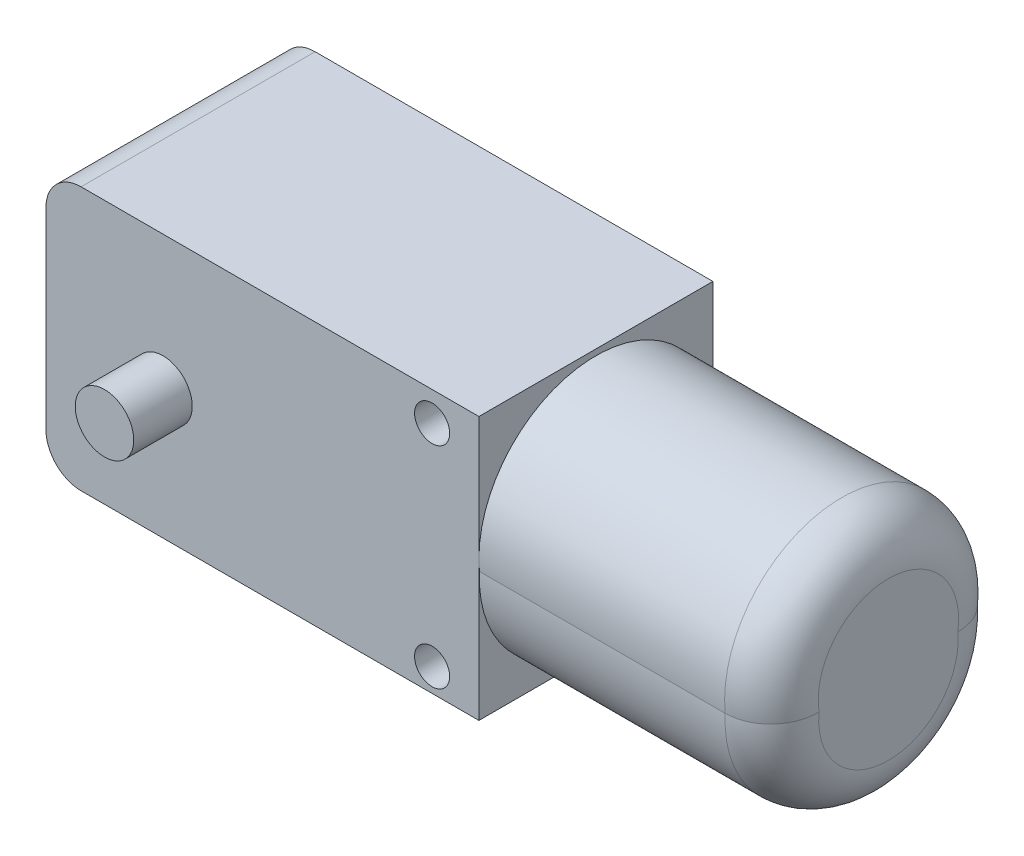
SolidWorks part; units mm, degrees
ref_plane "Front Plane" through (0, 0, 0) normal (0, 0, 1) x (1, 0, 0)
ref_plane "Top Plane" through (0, 0, 0) normal (0, 1, 0) x (1, 0, 0)
ref_plane "Right Plane" through (0, 0, 0) normal (1, 0, 0) x (0, 0, -1)
sketch "Sketch1" plane through (0, 0, 0) normal (0, 0, 1) x (1, 0, 0)
  line L1 (-64.2641, -2.5) -> (-27.2641, -2.5)
  line L2 (-64.2641, -2.5) -> (-64.2641, -25)
  line L3 (-64.2641, -25) -> (-27.2641, -25)
  line L4 (-27.2641, -2.5) -> (-27.2641, -25)
  dimension "D1" = 22.5
  dimension "D2" = 37
extrude "Boss-Extrude1" add sketch "Sketch1" against normal blind 20
sketch "Sketch2" plane through (-27.2641, 0, 0) normal (1, 0, 0) x (0, 0, -1)
  line L0 (20, -25) -> (0, -25) construction
  line L1 (20, -2.5) -> (0, -2.5) construction
  arc A0 (0.0501, -14) -> (19.9499, -14) centre (10, -14.5) ccw
  arc A1 (19.9499, -14) -> (0.0501, -14) centre (10, -13) ccw
  dimension "D2" = 12
  dimension "D1" = 12
extrude "Boss-Extrude2" add sketch "Sketch2" along normal blind 25
sketch "Sketch3" plane through (0, 0, 0) normal (0, 0, 1) x (1, 0, 0)
  circle A0 centre (-54.2641, -14) radius 2.5
  dimension "D1" = 5
extrude "Boss-Extrude3" add sketch "Sketch3" along normal blind 5
sketch "Sketch4" plane through (0, 0, -20) normal (0, 0, -1) x (-1, 0, 0)
  circle A1 centre (54.2641, -14) radius 2.5
  circle A2 centre (54.2641, -14) radius 2.5
  dimension "D1" = 0
extrude "Boss-Extrude4" add sketch "Sketch4" along normal blind 5
fillet "Fillet1" radius 3 2 edges at (-64.2641, -2.5, -10) (-64.2641, -25, -10)
fillet "Fillet2" radius 4 2 edges at (-2.2641, -3, -10) (-2.2641, -24.4624, -10)
sketch "Sketch5" plane through (-64.2641, 0, 0) normal (-1, 0, 0) x (0, 0, 1)
  line L0 (-10, -25) -> (-10, -2.5) construction
  line L1 (-8.625, -16.25) -> (-11.375, -16.25)
  line L2 (-8.625, -16.25) -> (-8.625, -11.25)
  line L3 (-8.625, -11.25) -> (-11.375, -11.25)
  line L4 (-11.375, -16.25) -> (-11.375, -11.25)
  line L5 (0, -25) -> (-20, -25) construction
  line L6 (0, -13.75) -> (-20, -13.75) construction
  line L7 (0, -5.5) -> (0, -22) construction
  line L8 (-20, -5.5) -> (-20, -22) construction
  dimension "D1" = 2.75
  dimension "D2" = 5
  dimension "D3" = 2.5
  dimension "D4" = 1.375
extrude "Boss-Extrude5" add sketch "Sketch5" along normal blind 5
sketch "Sketch6" plane through (0, 0, -11.375) normal (0, 0, -1) x (-1, 0, 0)
  line L1 (69.2641, -11.25) -> (64.2641, -11.25) construction
  line L2 (69.2641, -11.25) -> (69.2641, -16.25) construction
  circle A0 centre (66.7641, -13.75) radius 1.5
  dimension "D1" = 3
  dimension "D2" = 2.5
  dimension "D3" = 2.5
extrude "Cut-Extrude1" cut sketch "Sketch6" against normal up to surface (2.75 mm away)
sketch "Sketch7" plane through (0, 0, -20) normal (0, 0, -1) x (-1, 0, 0)
  line L0 (6.2641, -14) -> (27.2641, -14) construction
  line L1 (27.2641, -13) -> (27.2641, -2.5) construction
  line L2 (27.2641, -25) -> (27.2641, -13) construction
  circle A0 centre (31.2641, -5) radius 1.5
  circle A1 centre (31.2641, -23) radius 1.5
  dimension "D1" = 9
  dimension "D2" = 18
  dimension "D3" = 4
  dimension "D4" = 4
extrude "Cut-Extrude2" cut sketch "Sketch7" against normal through all
